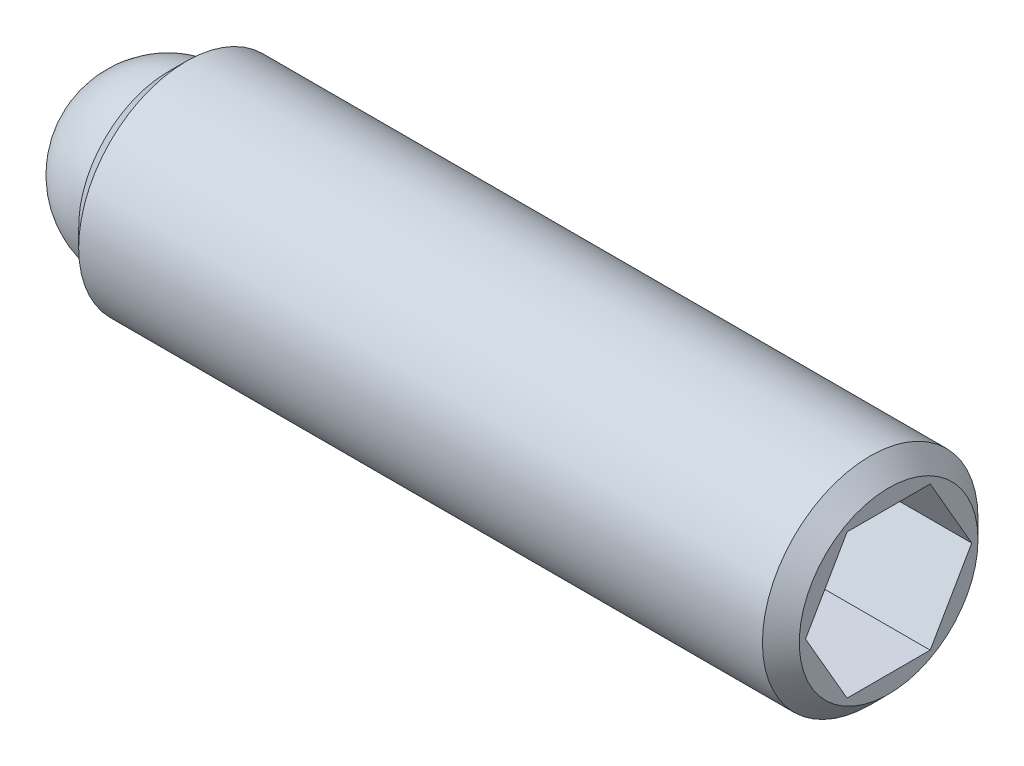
SolidWorks part; units mm, degrees
ref_plane "Front Plane" through (0, 0, 0) normal (0, 0, 1) x (1, 0, 0)
ref_plane "Top Plane" through (0, 0, 0) normal (0, 1, 0) x (1, 0, 0)
ref_plane "Right Plane" through (0, 0, 0) normal (1, 0, 0) x (0, 0, -1)
sketch "Sketch2" plane through (0, 0, 0) normal (1, 0, 0) x (0, 0, -1)
  circle A0 centre (0, 0) radius 1.4859
  dimension "D1" = 2.9718
extrude "Boss-Extrude1" add sketch "Sketch2" along normal blind 9.9346
sketch "Sketch3" plane through (0, 0, 0) normal (-1, 0, 0) x (0, 0, 1)
  circle A0 centre (0, 0) radius 1.1906
  dimension "D1" = 2.3813
chamfer "Chamfer1" distance 0.254 angle 45 1 edges at (0, 0, -1.4859)
chamfer "Chamfer2" distance 0.254 angle 45 1 edges at (9.9346, 0, -1.4859)
sketch "Sketch4" plane through (9.9346, 0, 0) normal (1, 0, 0) x (0, 0, -1)
  line L1 (1.1457, 0) -> (0.5728, 0.9922)
  line L2 (0.5728, 0.9922) -> (-0.5728, 0.9922)
  line L3 (-0.5728, 0.9922) -> (-1.1457, 0)
  line L4 (-1.1457, 0) -> (-0.5728, -0.9922)
  line L5 (-0.5728, -0.9922) -> (0.5728, -0.9922)
  line L6 (0.5728, -0.9922) -> (1.1457, 0)
  circle A0 centre (0, 0) radius 0.9922 construction
extrude "Cut-Extrude2" cut sketch "Sketch4" against normal blind 2.286
extrude "Cut-Extrude3" cut sketch "Sketch3" against normal blind 1.1906
sketch "Sketch5" plane through (0, 0, 0) normal (-1, 0, 0) x (0, 0, 1)
  line L0 (0, 0) -> (0, -1.1906)
  line L1 (0, 0) -> (0, 1.1906)
  arc A0 (0, 1.1906) -> (0, -1.1906) centre (0, 0) ccw
  dimension "D1" = 1.1906
revolve "Revolve1" add sketch "Sketch5" angle 360 about L1
